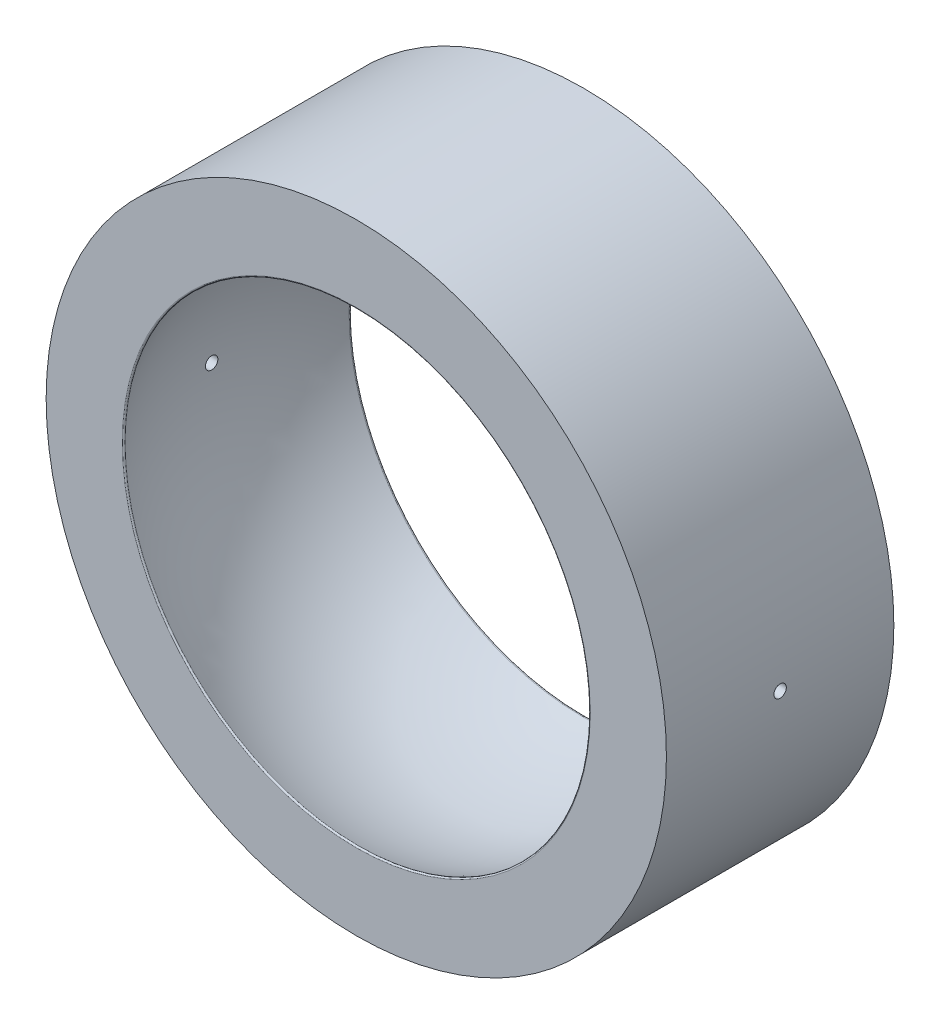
SolidWorks part; units mm, degrees
other "<Fixation Tirant_2>-<Palier rotule>"
ref_plane "Plan de face" through (0, 0, 0) normal (0, 0, 1) x (1, 0, 0)
ref_plane "Plan de dessus" through (0, 0, 0) normal (0, 1, 0) x (1, 0, 0)
ref_plane "Plan de droite" through (0, 0, 0) normal (1, 0, 0) x (0, 0, -1)
mirrored part "Fixation Tirant_2_Symétrique"
